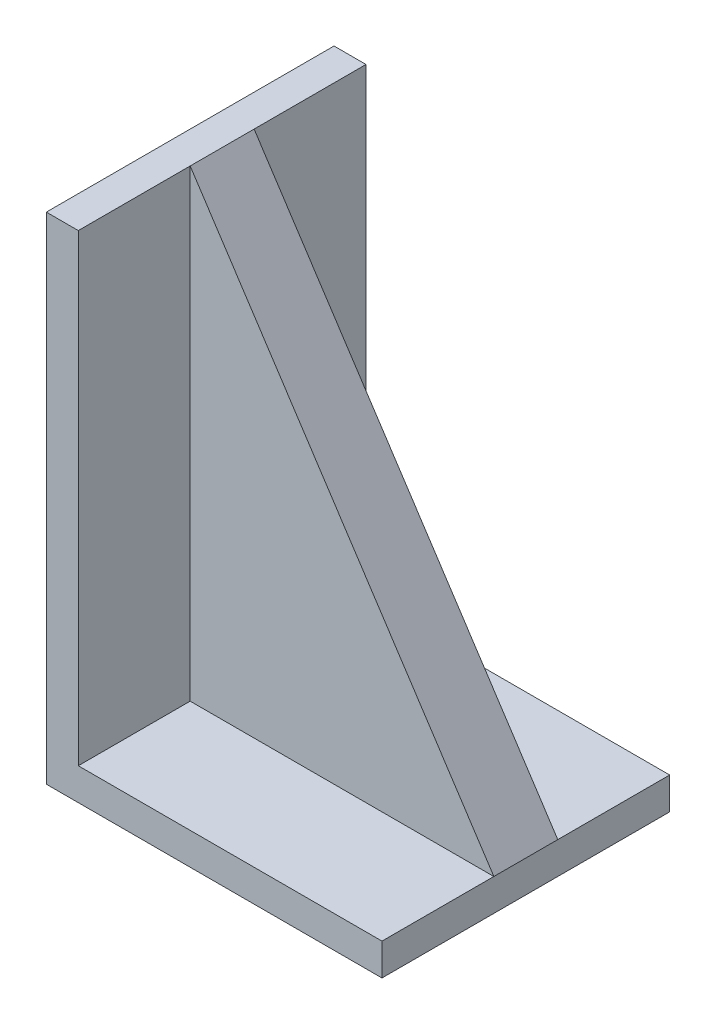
SolidWorks part; units mm, degrees
ref_plane "Front Plane" through (0, 0, 0) normal (0, 0, 1) x (1, 0, 0)
ref_plane "Top Plane" through (0, 0, 0) normal (0, 1, 0) x (1, 0, 0)
ref_plane "Right Plane" through (0, 0, 0) normal (1, 0, 0) x (0, 0, -1)
sketch "Sketch1" plane through (0, 0, 0) normal (0, 0, 1) x (1, 0, 0)
  line L0 (0, 75) -> (0, 0)
  line L1 (0, 0) -> (50, 0)
  dimension "D1" = 50
  dimension "D2" = 75
extrude "Extrude-Thin1" add sketch "Sketch1" along normal mid plane 45 thin
sketch "Sketch2" plane through (0, 0, 0) normal (0, 0, 1) x (1, 0, 0)
  line L0 (2.5, 75) -> (50, 2.5)
rib "Rib1" sketch "Sketch2" sketch "Sketch2" thickness 10 extrusion direction parallel to sketch draft on no parameters "D1"=10
